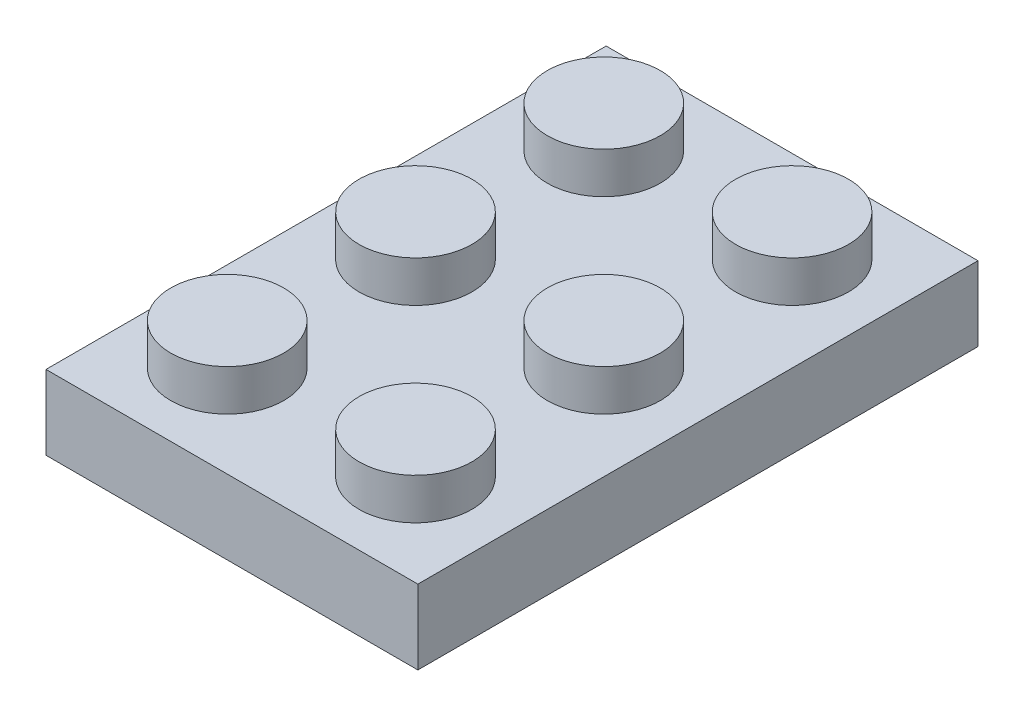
SolidWorks part; units mm, degrees
ref_plane "Front Plane" through (0, 0, 0) normal (0, 0, 1) x (1, 0, 0)
ref_plane "Top Plane" through (0, 0, 0) normal (0, 1, 0) x (1, 0, 0)
ref_plane "Right Plane" through (0, 0, 0) normal (1, 0, 0) x (0, 0, -1)
sketch "Sketch1" plane through (0, 0, 0) normal (0, 1, 0) x (1, 0, 0)
  line L1 (0, 0) -> (-15.8, 0)
  line L2 (0, 0) -> (0, 23.8)
  line L3 (0, 23.8) -> (-15.8, 23.8)
  line L4 (-15.8, 0) -> (-15.8, 23.8)
  dimension "D1" = 15.8
  dimension "D2" = 23.8
extrude "Extrude1" add sketch "Sketch1" along normal blind 3.16
sketch "Sketch2" plane through (0, 3.16, 0) normal (0, 1, 0) x (-1, 0, 0)
  line L0 (4, -26.6713) -> (4, -0.0593) construction
  line L2 (0, -23.8) -> (15.8, -23.8) construction
  line L3 (0, 0) -> (0, -23.8) construction
  circle A0 centre (4, -19.9) radius 2.4
  circle A1 centre (4, -11.9) radius 2.4
  circle A2 centre (4, -3.9) radius 2.4
  dimension "D1" = 4.8
  dimension "D2" = 4.8
  dimension "D3" = 4.8
  dimension "D4" = 11.9
  dimension "D5" = 8
  dimension "D6" = 8
  dimension "D7" = 4
extrude "Extrude4" add sketch "Sketch2" along normal blind 1.75
sketch "Sketch5" plane through (0, 0, 0) normal (0, -1, 0) x (1, 0, 0)
  line L0 (-15.8, 0) -> (0, 0) construction
  line L1 (-14.05, -1.75) -> (-1.75, -1.75)
  line L2 (-14.05, -1.75) -> (-14.05, -22.05)
  line L3 (-14.05, -22.05) -> (-1.75, -22.05)
  line L4 (-1.75, -1.75) -> (-1.75, -22.05)
  line L5 (0, 0) -> (0, -23.8) construction
  line L6 (-15.8, -23.8) -> (-15.8, 0) construction
  line L7 (0, -23.8) -> (-15.8, -23.8) construction
  dimension "D1" = 1.75
  dimension "D2" = 1.75
  dimension "D3" = 1.75
  dimension "D4" = 1.75
extrude "Extrude5" cut sketch "Sketch5" against normal blind 2.5
sketch "Sketch6" plane through (0, 2.5, 0) normal (0, -1, 0) x (1, 0, 0)
  line L0 (-7.9, 0) -> (-8.0492, -0.3511) construction
  line L1 (-15.8, 0) -> (0, 0) construction
  line L2 (-8.0492, -22.6317) -> (-8.0492, -0.3511) construction
  circle A0 centre (-8.0492, -8) radius 3.4
  circle A1 centre (-8.0492, -16) radius 3.4
  dimension "D1" = 6.8
  dimension "D2" = 6.8
  dimension "D3" = 8
  dimension "D4" = 8
extrude "Extrude6" add sketch "Sketch6" along normal blind 2.5
sketch "Sketch7" plane through (0, 0, 0) normal (0, -1, 0) x (1, 0, 0)
  circle A0 centre (-8.0492, -8) radius 2.4
  circle A1 centre (-8.0492, -16) radius 2.4
  circle A2 centre (-8.0492, -8) radius 3.4 construction
  circle A3 centre (-8.0492, -16) radius 3.4 construction
  dimension "D1" = 4.8
  dimension "D2" = 4.8
extrude "Extrude7" cut sketch "Sketch7" against normal blind 2.5
sketch "Sketch8" plane through (0, 3.16, 0) normal (0, 1, 0) x (1, 0, 0)
  line L0 (-7.9, 23.8) -> (-7.9, -0.1928) construction
  line L1 (0, 23.8) -> (-15.8, 23.8) construction
sketch "Sketch9" plane through (0, 3.16, 0) normal (0, 1, 0) x (1, 0, 0)
  line L0 (-15.8, 11.9) -> (1.8263, 11.9) construction
  line L1 (-15.8, 23.8) -> (-15.8, 0) construction
pattern_linear "LPattern1" count 2 spacing 8 along (-1, 0, 0) of "Extrude4"
